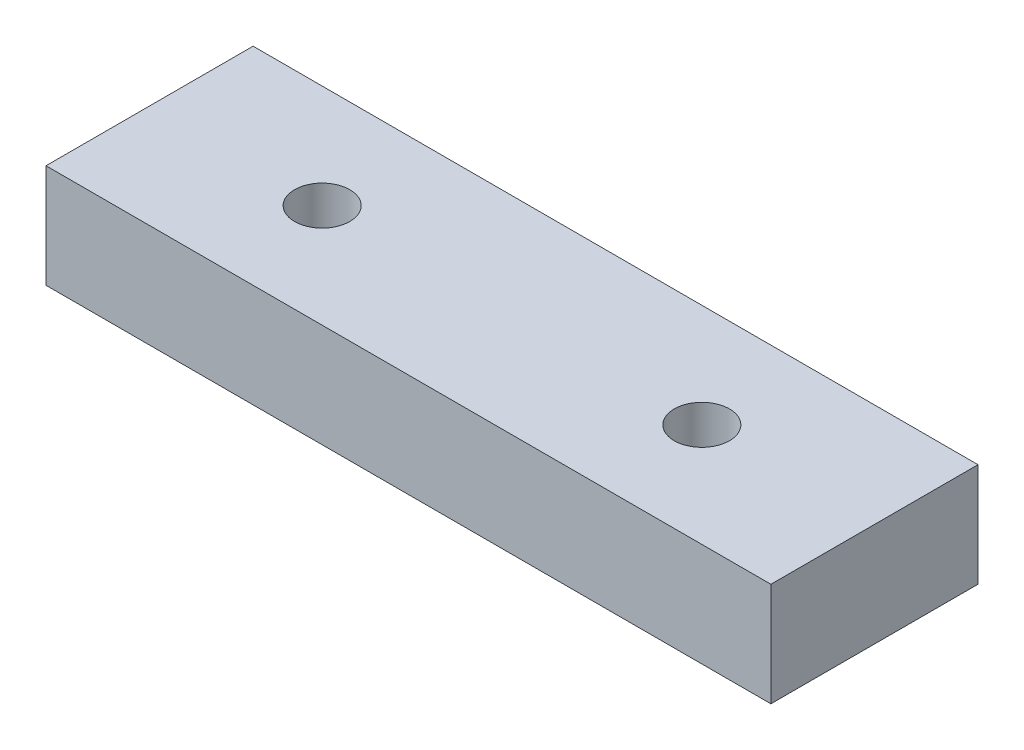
SolidWorks part; units mm, degrees
ref_plane "Спереди" through (0, 0, 0) normal (0, 0, 1) x (1, 0, 0)
ref_plane "Сверху" through (0, 0, 0) normal (0, 1, 0) x (1, 0, 0)
ref_plane "Справа" through (0, 0, 0) normal (1, 0, 0) x (0, 0, -1)
sketch "Эскиз1" plane through (0, 0, 0) normal (0, 1, 0) x (1, 0, 0)
  line L1 (0, 0) -> (42, 0)
  line L2 (0, 0) -> (0, 12)
  line L3 (0, 12) -> (42, 12)
  line L4 (42, 0) -> (42, 12)
  circle A0 centre (10, 6) radius 1.6
  circle A1 centre (32, 6) radius 1.6
  point P9 (0, 6)
  point P10 (21, 12)
extrude "Бобышка-Вытянуть1" add sketch "Эскиз1" along normal blind 6
equation "\"D6@Эскиз1\"=\"D5@Эскиз1\"/2"
